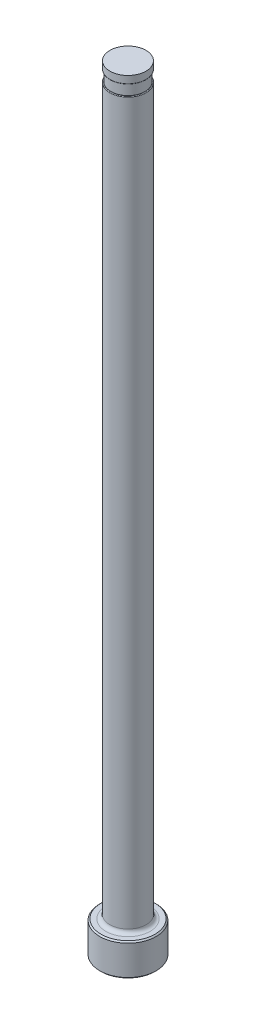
SolidWorks part; units mm, degrees
ref_plane "Front Plane" through (0, 0, 0) normal (0, 0, 1) x (1, 0, 0)
ref_plane "Top Plane" through (0, 0, 0) normal (0, 1, 0) x (1, 0, 0)
ref_plane "Right Plane" through (0, 0, 0) normal (1, 0, 0) x (0, 0, -1)
other "Configuration Table"
sketch "Sketch1" plane through (0, 0, 0) normal (0, 0, 1) x (1, 0, 0)
  line L0 (0, 259.9588) -> (0, -15.1925) construction
  line L1 (0, 0) -> (-5.5499, 0)
  line L2 (-5.5499, 0) -> (-5.5499, 6.35)
  line L3 (-5.5499, 6.35) -> (-3.5712, 6.35)
  line L4 (-3.5712, 6.35) -> (-3.5712, 152.4)
  line L5 (-3.5712, 152.4) -> (0, 152.4)
  line L6 (0, 152.4) -> (0, 0)
  dimension "L" = 152.4
  dimension "H" = 11.0998
  dimension "T" = 6.35
  dimension "D" = 7.1425
revolve "Revolve1" add sketch "Sketch1" angle 360 about L0
chamfer "Chamfer1" distance 0.254 angle 45 2 edges at (0, 6.35, 5.5499) (0, 0, 5.5499)
fillet "Fillet1" radius 0.762 1 edges at (0, 6.35, 3.5712)
sketch "Sketch2" plane through (0, 0, 0) normal (0, 0, 1) x (1, 0, 0)
  line L0 (-3.5712, 152.4) -> (-3.5712, 7.112) construction
  line L1 (-3.5712, 150.876) -> (-3.368, 150.876)
  line L2 (-3.5712, 150.876) -> (-3.5712, 148.844)
  line L3 (-3.5712, 148.844) -> (-3.368, 148.844)
  line L4 (-3.368, 150.876) -> (-3.368, 148.844)
  line L5 (3.5712, 152.4) -> (-3.5712, 152.4) construction
  line L6 (0, 153.4483) -> (0, 147.3282) construction
  dimension "D1" = 2.032
  dimension "N" = 1.524
  dimension "FD" = 0.2032
  dimension "D3" = 6.7361
revolve "Vent Relief" cut sketch "Sketch2" angle 360 about L6
sketch "Sketch3" plane through (0, 0, 0) normal (0, 0, 1) x (1, 0, 0)
  line L0 (-3.368, 149.86) -> (-3.368, 86.36)
  line L1 (-3.368, 150.876) -> (-3.368, 148.844) construction
  line L2 (-3.5712, 148.844) -> (-3.5712, 7.112) construction
  line L3 (-3.5712, 85.2424) -> (-3.5712, 149.86)
  line L4 (-3.5712, 149.86) -> (-3.368, 149.86)
  arc A0 (-3.368, 86.36) -> (-3.5712, 85.2424) centre (-6.543, 86.36) cw
  dimension "D1" = 3.175
  dimension "D2" = 63.5
extrude "D-Slot" cut sketch "Sketch3" against normal through all both and the other way through all
sketch "Sketch5" plane through (0, 0, 0) normal (0, 0, 1) x (1, 0, 0)
  line L0 (-3.5712, 150.876) -> (3.5712, 150.876) construction
  line L1 (-3.5712, 152.4) -> (-3.5458, 152.4)
  line L2 (-3.5712, 152.4) -> (-3.5712, 150.876)
  line L3 (-3.5712, 150.876) -> (-3.5458, 150.876)
  line L4 (-3.5458, 152.4) -> (-3.5458, 150.876)
  line L5 (0, 152.6877) -> (0, 150.5771) construction
  dimension "VP" = 0.0254
revolve "Vent Diameter" cut sketch "Sketch5" angle 360 about L5
fillet "Fillet2" radius 0.127 2 edges at (3.5712, 148.844, 0) (0, 150.876, 3.5458)
sketch "Pocket Sketch" plane through (0, 0, 0) normal (0, 0, 1) x (1, 0, 0)
  line L0 (-5.9468, 0) -> (-5.9468, 6.3754)
  line L1 (-5.9468, 6.3754) -> (-4.5317, 6.3754)
  line L2 (-3.7697, 7.1374) -> (-3.7697, 22.225)
  line L3 (-3.7697, 22.225) -> (0, 22.225)
  line L4 (0, 22.225) -> (0, 0)
  line L5 (0, 0) -> (-5.9468, 0)
  line L6 (0, 12.6104) -> (0, -2.4989) construction
  line L7 (-5.5499, 6.096) -> (-5.5499, 0.254) construction
  line L8 (5.2959, 6.35) -> (-5.2959, 6.35) construction
  line L9 (-3.5712, 85.2424) -> (-3.5712, 7.112) construction
  line L10 (-4.5317, 6.3754) -> (-3.7697, 7.1374)
  point P3 (-3.7697, 6.3754)
  dimension "D1" = 11.8935
  dimension "D2" = 0.3969
  dimension "D3" = 0.0254
  dimension "D4" = 0.1984
  dimension "D5" = 7.5394
  dimension "D6" = 22.225
